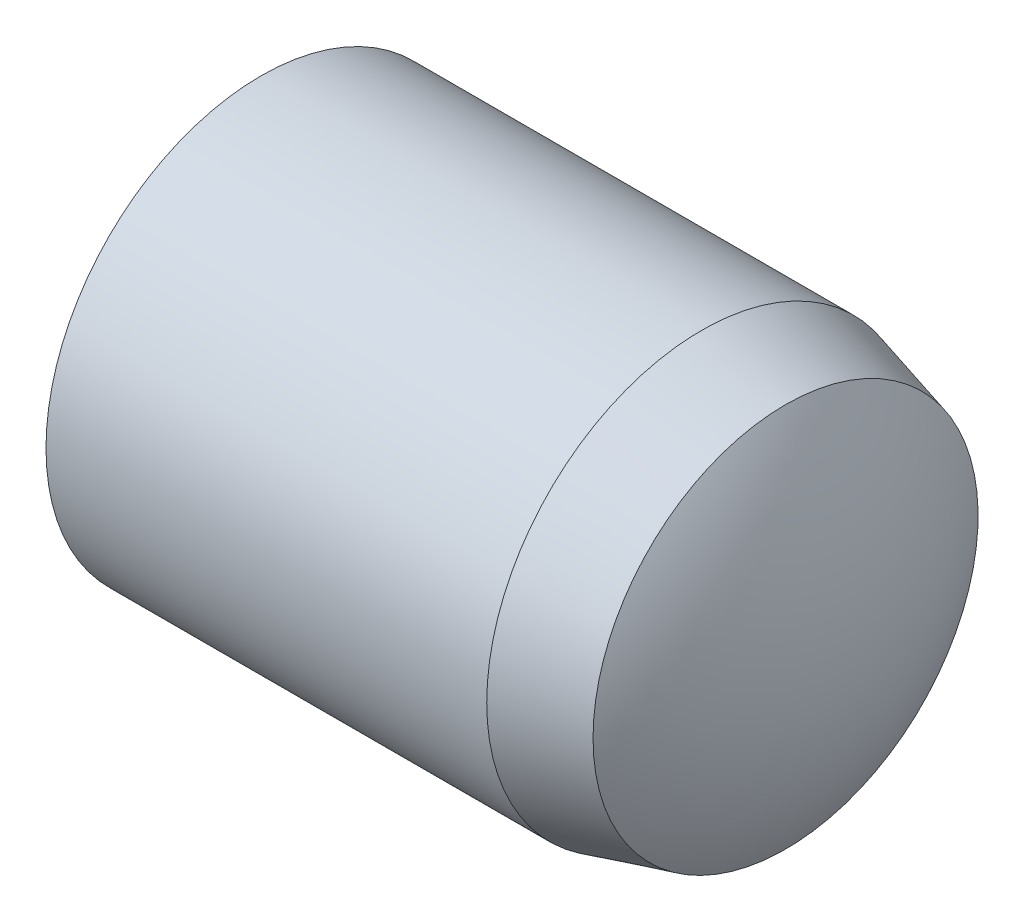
SolidWorks part; units mm, degrees
ref_plane "Front Plane" through (0, 0, 0) normal (0, 0, 1) x (1, 0, 0)
ref_plane "Top Plane" through (0, 0, 0) normal (0, 1, 0) x (1, 0, 0)
ref_plane "Right Plane" through (0, 0, 0) normal (1, 0, 0) x (0, 0, -1)
sketch "Sketch1" plane through (0, 0, 0) normal (0, 0, 1) x (1, 0, 0)
  line L0 (-6, 0) -> (6, 0) construction
  line L1 (6, 4) -> (6, -4) construction
  line L2 (-6, 4) -> (-6, -4) construction
  line L3 (3.4, 4) -> (3.4, -4) construction
  line L4 (-4.8, 4) -> (-4.8, -4) construction
  line L5 (-6, 0) -> (-4.8, 0) construction
  line L6 (6, 0) -> (3.4, 0) construction
  line L7 (4.96, 4) -> (4.96, -4) construction
sketch "Sketch2" plane through (0, 0, 0) normal (1, 0, 0) x (0, 0, -1)
  circle A0 centre (0, 0) radius 4
extrude "Extrude1" add sketch "Sketch2" against normal up to vertex (6 mm away) and the other way up to vertex (6 mm away)
sketch "Sketch5" plane through (0, 0, 0) normal (0, 0, 1) x (1, 0, 0)
  line L0 (3.4, 4) -> (3.4, 4.5)
  line L1 (3.4, 4.5) -> (6.5, 4.5)
  line L2 (6.5, 4.5) -> (6.5, 0)
  line L3 (6, 0) -> (6.5, 0)
  line L5 (-4.8, 4) -> (-4.8, 4.5)
  line L6 (-4.8, 4.5) -> (-6.5, 4.5)
  line L7 (-6.5, 4.5) -> (-6.5, 0)
  line L8 (3.4, 4) -> (4.96, 3.582)
  line L10 (-6, 0) -> (-6.5, 0)
  line L11 (-6, 4) -> (-6, -4) construction
  line L13 (3.4, 4) -> (3.4, -4) construction
  line L15 (-6, 0) -> (6, 0) construction
  line L16 (4.96, 4) -> (4.96, -4) construction
  line L17 (6, 4) -> (6, -4) construction
  arc A0 (4.96, 3.582) -> (6, 0) centre (-0.6886, 0) cw
  arc A1 (-4.8, 4) -> (-6, 0) centre (1.2667, 0) ccw
  dimension "D1" = 15
  dimension "D2" = 0.5
revolve "Cut-Revolve1" cut sketch "Sketch5" angle 360 about L0
equation "\"D1@Sketch1\" = \"Dia@Sketch1\"*.325"
equation "\"D2@Sketch1\" = \"Dia@Sketch1\"*.15"
equation "\"D3@Sketch1\" = \"D1@Sketch1\"*.6"
